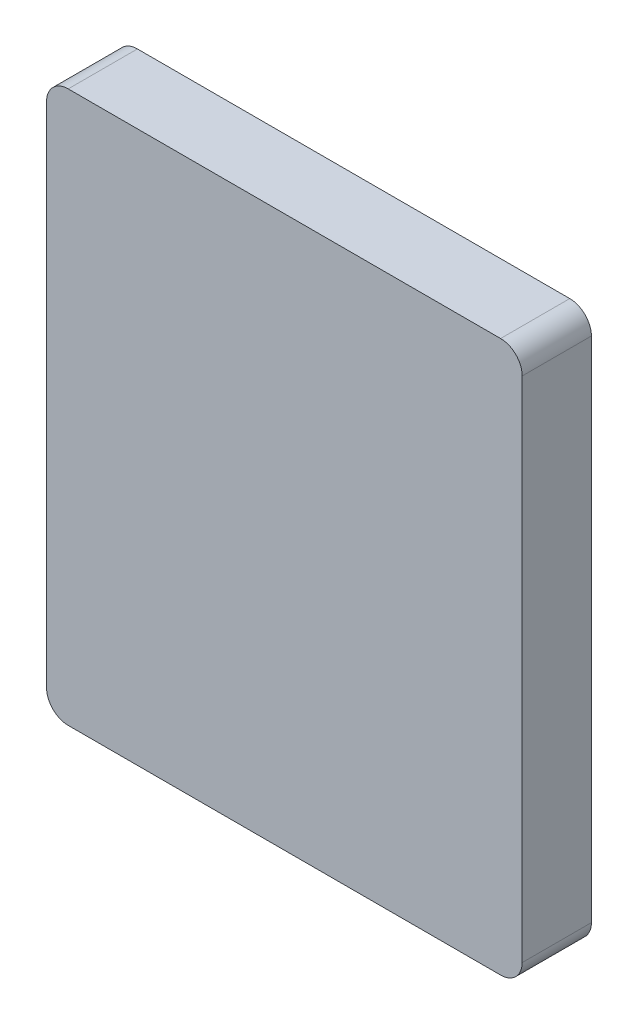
SolidWorks part; units mm, degrees
ref_plane "Front Plane" through (0, 0, 0) normal (0, 0, 1) x (1, 0, 0)
ref_plane "Top Plane" through (0, 0, 0) normal (0, 1, 0) x (1, 0, 0)
ref_plane "Right Plane" through (0, 0, 0) normal (1, 0, 0) x (0, 0, -1)
sketch "Sketch1" plane through (0, 0, 0) normal (0, 0, 1) x (1, 0, 0)
  line L1 (0, 0) -> (55.88, 0)
  line L2 (0, 0) -> (0, 64.77)
  line L3 (0, 64.77) -> (55.88, 64.77)
  line L4 (55.88, 0) -> (55.88, 64.77)
  dimension "D1" = 55.88
  dimension "D2" = 64.77
extrude "Boss-Extrude1" add sketch "Sketch1" along normal blind 8.128
fillet "Fillet1" radius 2.54 4 edges at (0, 64.77, 4.064) (0, 0, 4.064) (55.88, 0, 4.064) (55.88, 64.77, 4.064)
